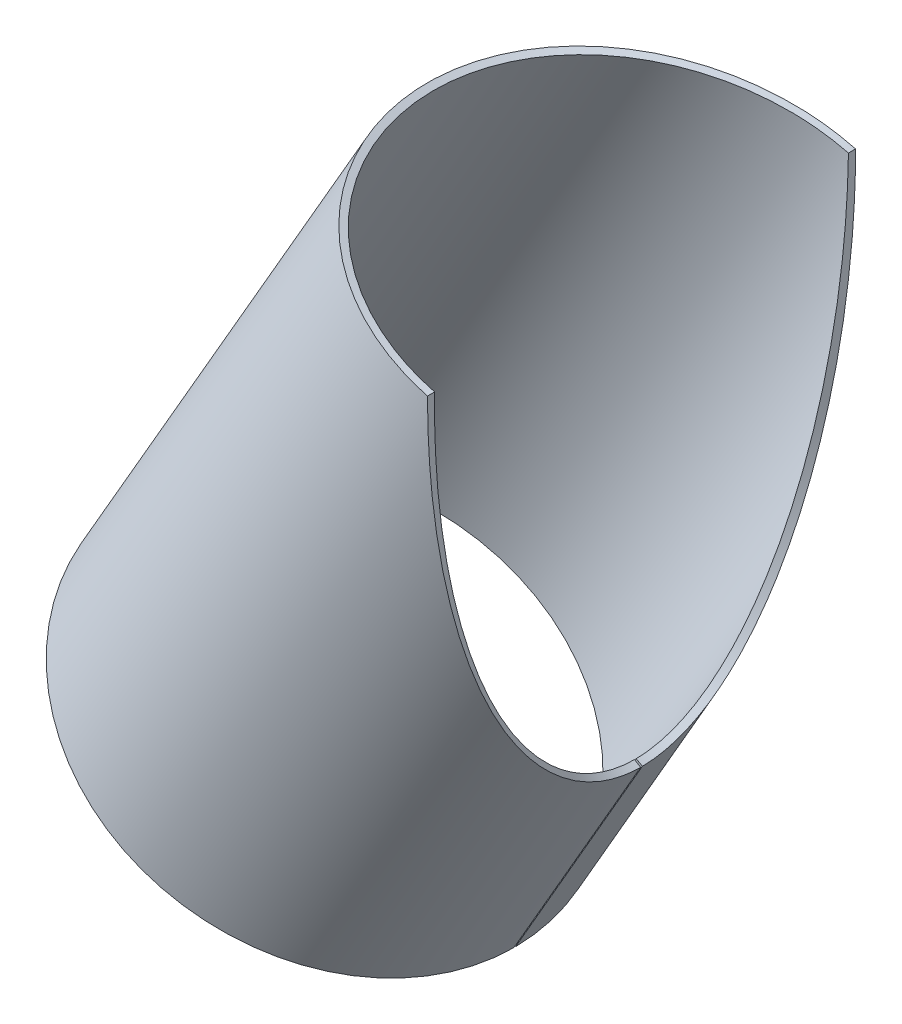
SolidWorks part; units mm, degrees
ref_plane "前视基准面" through (0, 0, 0) normal (0, 0, 1) x (1, 0, 0)
ref_plane "上视基准面" through (0, 0, 0) normal (0, 1, 0) x (1, 0, 0)
ref_plane "右视基准面" through (0, 0, 0) normal (1, 0, 0) x (0, 0, -1)
imported_body "基体零件-Y形管-1"
sheet metal parameters "钣金1" parameters "D1"=0.7366, "厚度"=4
bend "圆角折弯1" bend radius 116 bend angle 359.523 parameters "D5"=1
flatten bends "展开-折弯1" parameters "D1"=0
sketch "尖角-草图1" plane through (-35.5389, -301.5531, -0.5) normal (0.866, -0.5, -0.0042) x (-0.0036, 0.0021, -1)
  line L0 (363.9414, 71.0779) -> (363.9414, -71.0779) construction
process bends "加工-折弯1" parameters "D1"=0
sketch "平面-草图1" plane through (-35.5389, -301.5531, -0.5) normal (0.866, -0.5, -0.0042) x (-0.0036, 0.0021, -1)
